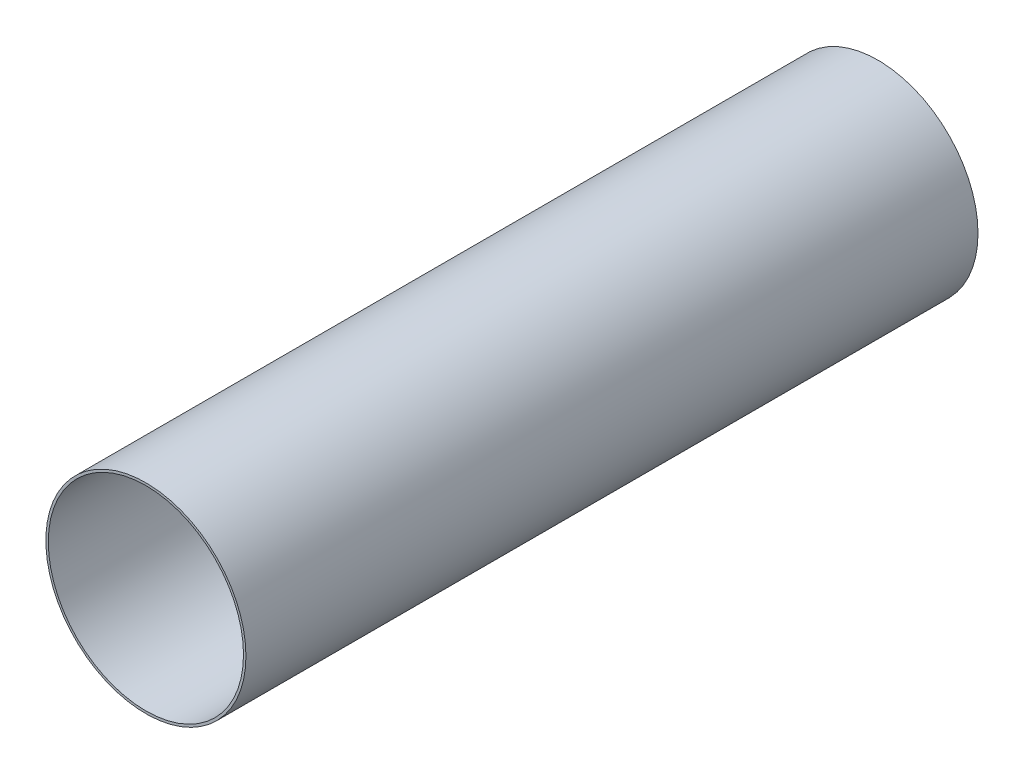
SolidWorks part; units mm, degrees
ref_plane "Front Plane" through (0, 0, 0) normal (0, 0, 1) x (1, 0, 0)
ref_plane "Top Plane" through (0, 0, 0) normal (0, 1, 0) x (1, 0, 0)
ref_plane "Right Plane" through (0, 0, 0) normal (1, 0, 0) x (0, 0, -1)
sketch "Sketch1" plane through (0, 0, 0) normal (0, 0, 1) x (1, 0, 0)
  circle A0 centre (0, 0) radius 82
  circle A1 centre (0, 0) radius 80
  dimension "D1" = 160
  dimension "D2" = 164
extrude "Boss-Extrude1" add sketch "Sketch1" along normal mid plane 600
